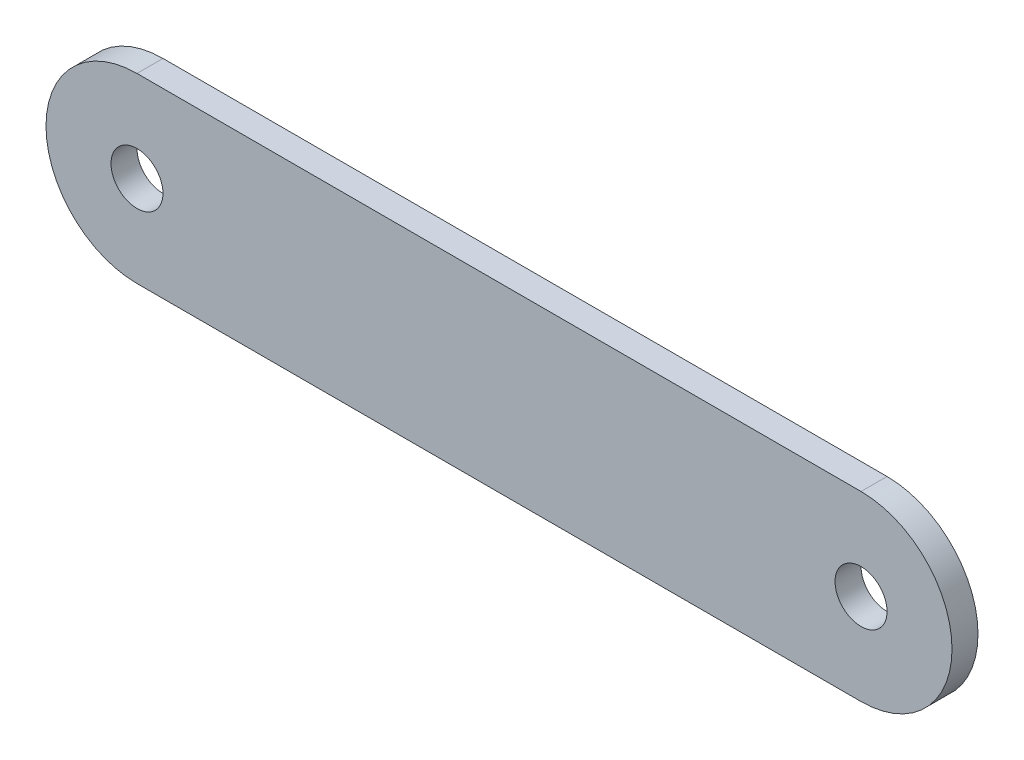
SolidWorks part; units mm, degrees
ref_plane "Front Plane" through (0, 0, 0) normal (0, 0, 1) x (1, 0, 0)
ref_plane "Top Plane" through (0, 0, 0) normal (0, 1, 0) x (1, 0, 0)
ref_plane "Right Plane" through (0, 0, 0) normal (1, 0, 0) x (0, 0, -1)
sketch "Sketch1" plane through (0, 0, 0) normal (0, 0, 1) x (1, 0, 0)
  line L0 (0, 0) -> (1415, 0) construction
  line L1 (0, 177.8) -> (1415, 177.8)
  line L2 (0, -177.8) -> (1415, -177.8)
  arc A0 (0, 177.8) -> (0, -177.8) centre (0, 0) ccw
  arc A1 (1415, -177.8) -> (1415, 177.8) centre (1415, 0) ccw
  circle A2 centre (0, 0) radius 50.8
  circle A3 centre (1415, 0) radius 50.8
  point P3 (707.5, 0)
  dimension "D2" = 101.6
  dimension "D1" = 1415
  dimension "D3" = 355.6
extrude "Boss-Extrude1" add sketch "Sketch1" along normal blind 50.8
